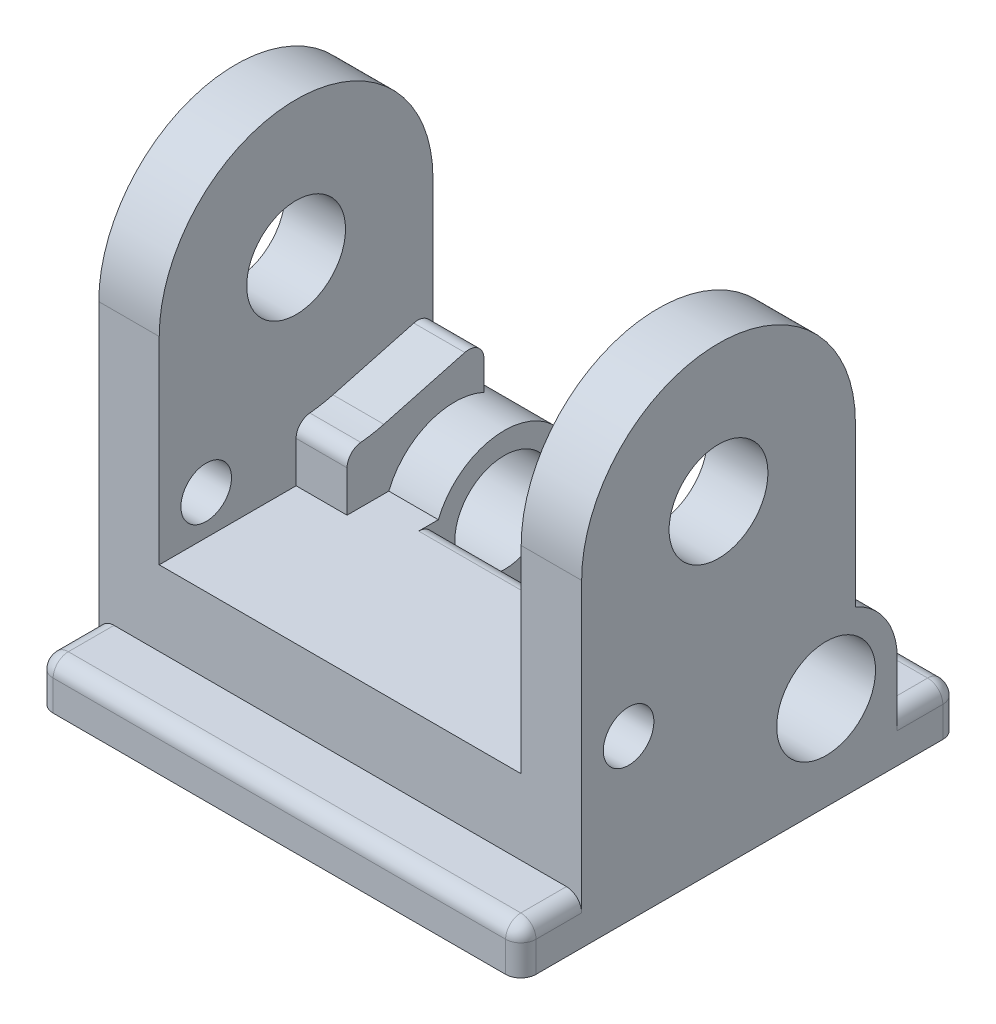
SolidWorks part; units mm, degrees
ref_plane "Front Plane" through (0, 0, 0) normal (0, 0, 1) x (1, 0, 0)
ref_plane "Top Plane" through (0, 0, 0) normal (0, 1, 0) x (1, 0, 0)
ref_plane "Right Plane" through (0, 0, 0) normal (1, 0, 0) x (0, 0, -1)
inserted part "params_finger_t42"
inserted part "params_print"
sketch "Sketch1" plane through (0, 0, 0) normal (1, 0, 0) x (0, 0, -1)
  line L0 (37.075, 0) -> (0, 0) construction
  line L1 (30, 11.9353) -> (59.2255, 11.9353) construction
  line L2 (32.3294, 12.2419) -> (68.1197, 21.8319) construction
  line L3 (21, 20.9353) -> (21, 3)
  line L4 (21, 3) -> (17, 3)
  line L5 (17, 3) -> (17, 0)
  line L6 (17, 0) -> (45.75, 0)
  line L7 (45.75, 0) -> (45.75, 3)
  line L8 (45.75, 3) -> (41.75, 3)
  line L9 (41.75, 6.175) -> (41.75, 3)
  line L10 (39, 20.9353) -> (39, 10.4353)
  circle A0 centre (37.075, 6.175) radius 3.175
  circle A1 centre (30, 20.9353) radius 3.175
  circle A2 centre (37.075, 6.175) radius 6.175 construction
  circle A3 centre (37.075, 6.175) radius 4.675 construction
  circle A4 centre (30, 20.9353) radius 9 construction
  circle A5 centre (30, 20.9353) radius 8 construction
  arc A6 (21, 20.9353) -> (39, 20.9353) centre (30, 20.9353) cw
  circle A7 centre (37.075, 6.175) radius 1.5875 construction
  arc A8 (41.75, 6.175) -> (39, 10.4353) centre (37.075, 6.175) ccw
  circle A9 centre (36.7062, 12.4118) radius 0.7937 construction
  circle A10 centre (36.7062, 12.4118) radius 0.9687 construction
  point P8 (40.25, 6.175)
  point P30 (37.5, 12.4118)
  dimension "D1" = 6.35
  dimension "D2" = 6.35
  dimension "D4" = 3
  dimension "D5" = 1.5
  dimension "D6" = 18
  dimension "D8" = 16
  dimension "D10" = 3.175
  dimension "D14" = 1.5875
  dimension "D15" = 0.175
  dimension "D3" = 30
  dimension "D7" = 40.25
  dimension "D9" = 15
  dimension "D11" = 3
  dimension "D12" = 4
  dimension "D13" = 1.5
  dimension "D16" = 1.5
extrude "Main Body" add sketch "Sketch1" against normal blind 15.875
sketch "Sketch2" plane through (0, 0, 0) normal (1, 0, 0) x (0, 0, -1)
  line L0 (21, 20.9353) -> (21, 7.9353)
  line L1 (21, 20.9353) -> (21, 3) construction
  line L2 (21, 7.9353) -> (32.7441, 7.9353)
  line L3 (39, 20.9353) -> (39, 10.4353)
  arc A0 (39, 20.9353) -> (21, 20.9353) centre (30, 20.9353) ccw construction
  arc A1 (39, 20.9353) -> (21, 20.9353) centre (30, 20.9353) ccw
  circle A2 centre (30, 20.9353) radius 9 construction
  circle A3 centre (37.075, 6.175) radius 4.675 construction
  arc A4 (41.75, 6.175) -> (39, 10.4353) centre (37.075, 6.175) ccw construction
  arc A5 (39, 10.4353) -> (32.7441, 7.9353) centre (37.075, 6.175) ccw
  circle A6 centre (37.075, 6.175) radius 3.175 construction
  point P14 (30, 11.9353)
  dimension "D1" = 4
extrude "Finger Clearance" cut sketch "Sketch2" against normal blind 11.9
sketch "Sketch3" plane through (0, 0, 0) normal (1, 0, 0) x (0, 0, -1)
  line L0 (32.4, 6.175) -> (41.75, 6.175) construction
  line L2 (32.4, 6.175) -> (32.4, 0)
  line L3 (17, 0) -> (45.75, 0) construction
  line L4 (32.4, 0) -> (41.75, 0)
  line L5 (41.75, 0) -> (41.75, 6.175)
  arc A0 (32.4, 6.175) -> (41.75, 6.175) centre (37.075, 6.175) cw
  arc A1 (41.75, 6.175) -> (32.7441, 7.9353) centre (37.075, 6.175) ccw construction
extrude "Pulley Clearance" cut sketch "Sketch3" against normal blind 5.2917
sketch "Sketch4" plane through (-11.9, 0, 0) normal (1, 0, 0) x (0, 0, -1)
  line L0 (21, 7.9353) -> (32.7441, 7.9353) construction
  line L1 (30, 7.9353) -> (32.7441, 7.9353)
  line L2 (30, 11.9353) -> (34.3828, 11.9353) construction
  line L3 (32.3294, 12.2419) -> (43.6558, 15.2768) construction
  line L4 (30, 11.5853) -> (30, 7.9353)
  line L5 (32.42, 11.9039) -> (39, 13.667)
  line L6 (39, 10.4353) -> (39, 20.9353) construction
  line L7 (39, 13.667) -> (39, 10.4353)
  arc A0 (39, 10.4353) -> (32.7441, 7.9353) centre (37.075, 6.175) ccw construction
  arc A1 (39, 10.4353) -> (32.7441, 7.9353) centre (37.075, 6.175) ccw
  circle A2 centre (30, 20.9353) radius 9 construction
  arc A3 (39, 20.9353) -> (21, 20.9353) centre (30, 20.9353) ccw construction
  circle A4 centre (30, 20.9353) radius 9.35 construction
  arc A5 (30, 11.5853) -> (32.42, 11.9039) centre (30, 20.9353) ccw
  dimension "D2" = 0.35
  dimension "D1" = 15
extrude "Proximal Offset" add sketch "Sketch4" along normal blind 3.35
sketch "Sketch7" plane through (-11.9, 0, 0) normal (1, 0, 0) x (0, 0, -1)
  line L0 (21, 20.9353) -> (21, 7.9353) construction
  line L1 (21, 7.9353) -> (30, 7.9353) construction
  circle A0 centre (24.0875, 10.5228) radius 1.5875
  circle A2 centre (24.0875, 10.5228) radius 2.5875 construction
  point P5 (22.5, 10.5228)
  dimension "D1" = 1
  dimension "D3" = 3.175
  dimension "D2" = 1.5
extrude "Extension Spring Anchor" cut sketch "Sketch7" against normal through all
mirror "Mirror" about plane through (0, 0, 0) normal (1, 0, 0) of "Extension Spring Anchor", "Proximal Offset", "Pulley Clearance", "Finger Clearance", "Main Body"
sketch "Sketch8" plane through (15.875, 0, 0) normal (1, 0, 0) x (0, 0, -1)
  circle A0 centre (30, 20.9353) radius 3.25
  circle A1 centre (24.0875, 10.5228) radius 1.6625
  circle A2 centre (37.075, 6.175) radius 3.25
  circle A3 centre (30, 20.9353) radius 3.175 construction
  circle A4 centre (24.0875, 10.5228) radius 1.5875 construction
  dimension "D1" = 0.075
  dimension "D2" = 0.075
extrude "Print Clearances - Pins" cut sketch "Sketch8" against normal through all
fillet "Contouring" radius 1 15 edges at (-15.875, 3, -19) (15.875, 3, -19) (15.875, 1.5, -17) (15.875, 1.5, -45.75) (15.875, 3, -43.75) (-15.875, 1.5, -17) (0, 3, -45.75) (0, 3, -17) (10.225, 11.5853, -30) (10.225, 13.667, -39) (-15.875, 1.5, -45.75) (-15.875, 3, -43.75) (0, 7.9353, -32.7441) (-10.225, 13.667, -39) (-10.225, 11.5853, -30)
ref_point "Point1"
equation "\"D1@Sketch1\"  = \"base pin diameter@values@params_print.sldprt\""
equation "\"D2@Sketch1\"=\"base pin diameter@values@params_print.sldprt\""
equation "\"D3@Sketch1\"  = \"Lb Pivot@values@params_finger_t42.sldprt\" / 2"
equation "\"D4@Sketch1\"=\"width keep@values@params_print.sldprt\""
equation "\"D5@Sketch1\"  = \"width keep@values@params_print.sldprt\" / 2"
equation "\"D6@Sketch1\"  = \"height@values@params_finger_t42.sldprt\""
equation "\"D8@Sketch1\"  = \"Rp@values@params_finger_t42.sldprt\" * 2"
equation "\"D9@Sketch1\"  = \"Tp@values@params_finger_t42.sldprt\""
equation "\"D10@Sketch1\"  = \"pin diameter@values@params_print.sldprt\""
equation "\"D11@Sketch1\"  = \"width keep@values@params_print.sldprt\""
equation "\"D12@Sketch1\"  = \"width tab@values@params_print.sldprt\""
equation "\"D13@Sketch1\"  = \"width keep@values@params_print.sldprt\" / 2"
equation "\"D14@Sketch1\" = \"pin diameter@values@params_print.sldprt\" / 2"
equation "\"D15@Sketch1\"  = \"print free@values@params_print.sldprt\" / 2"
equation "\"D16@Sketch1\"  = \"width keep@values@params_print.sldprt\" / 2"
equation "\"D1@Finger Clearance\"=\"depth@values@params_finger_t42.sldprt\" / 2 + \"print free@values@params_print.sldprt\"-1.5*\"width keep@values@params_print.sldprt\"+\"print free@values@params_print.sldprt\"/2"
equation "\"D1@Pulley Clearance\"=\"depth@values@params_finger_t42.sldprt\"/6"
equation "\"D1@Sketch4\"  = \"Tp@values@params_finger_t42.sldprt\""
equation "\"D2@Sketch4\"  = \"print free@values@params_print.sldprt\""
equation "\"D1@Proximal Offset\"  = \"width keep@values@params_print.sldprt\" + \"print free@values@params_print.sldprt\""
equation "\"D2@Sketch7\"  = \"width keep@values@params_print.sldprt\" / 2"
equation "\"D1@Main Body\" = \"depth@values@params_finger_t42.sldprt\" / 2"
equation "\"D3@Sketch7\"=\"pin diameter@values@params_print.sldprt\""
equation "\"D1@Sketch8\"=\"print fit@values@params_print.sldprt\"/2"
equation "\"D2@Sketch8\"=\"print fit@values@params_print.sldprt\"/2"
